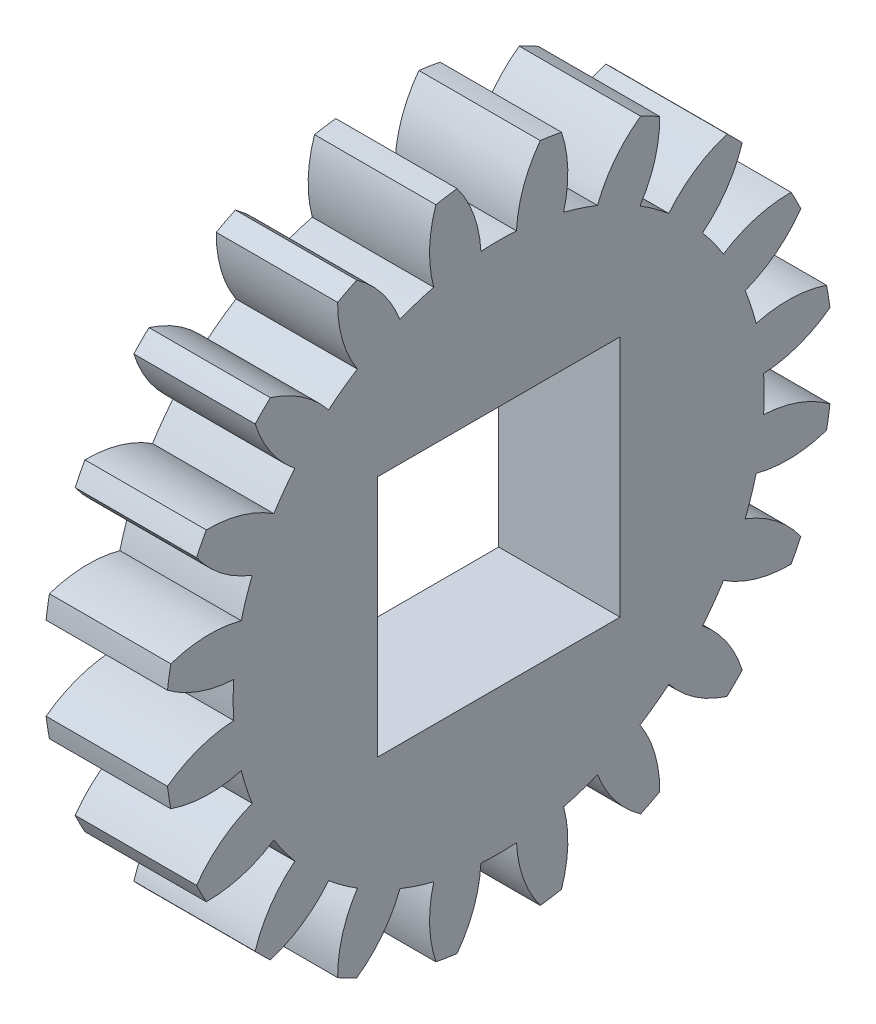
SolidWorks part; units mm, degrees
ref_plane "Plane1" through (0, 0, 0) normal (0, 0, 1) x (1, 0, 0)
ref_plane "Plane2" through (0, 0, 0) normal (0, 1, 0) x (1, 0, 0)
ref_plane "Plane3" through (0, 0, 0) normal (1, 0, 0) x (0, 0, -1)
sketch "HoldingSke" plane through (0, 0, 0) normal (0, 1, 0) x (1, 0, 0)
  line L0 (0, 0) -> (381.8911, -138.997)
  line L1 (-15, 0) -> (100, 0) construction
  line L2 (0, 0) -> (-2.1039, 2.3779)
  line L3 (0, 0) -> (-11.863, 4.5341)
  line L4 (0, 0) -> (8.1152, 2.9537)
  line L5 (0, 0) -> (-47.5972, -17.7524)
  line L6 (0, 0) -> (-5.2639, -3.5516)
  line L7 (-2.1039, 2.3779) -> (8.8308, 51.9871)
  line L8 (-76.2, 54.61) -> (-69.596, 54.61)
  line L9 (-67.7845, 28.3722) -> (-49.3413, 33.142)
  line L10 (-76.2, 71.12) -> (104.1128, 71.12)
  line L11 (0, 0) -> (-6.35, 0)
  line L12 (-76.2, 101.6) -> (-76.1428, 101.6)
  line L13 (24.9733, 27.94) -> (52.9518, 28.4284)
  line L14 (24.9733, 27.94) -> (24.9746, 27.94)
  line L15 (24.9733, 27.94) -> (100.4006, 29.5858)
  circle A0 centre (0, 0) radius 3.175
  circle A1 centre (0, 0) radius 13.8894
  circle A2 centre (0, 0) radius 38.1
  circle A3 centre (0, 0) radius 3.175
  dimension "MHD" = 27.7787
  dimension "Hub_dia" = 76.2
  dimension "Bore" = 6.35
  dimension "MBD" = 6.35
  dimension "Num_teeth" = 20
  dimension "Pitch_radius" = 180.3128
  dimension "Pitch" = 406.4
  dimension "Width" = 6.35
  dimension "Overall_len" = 50.8
  dimension "Show_teeth" = 20
  dimension "Thickness" = 6.35
  dimension "OAL" = 50.8001
  dimension "T_dim" = 6.604
  dimension "Ap" = 14.5
  dimension "H" = 19.05
  dimension "Backlash" = 0.0571
  dimension "Addendum_fac" = 1
  dimension "Dedendum_fac" = 1.25
  dimension "Clearance_fac" = 0.25
  dimension "Dedendum_add" = 0.0013
sketch "BasProSke" plane through (0, 0, 0) normal (0, 1, 0) x (1, 0, 0)
  line L0 (-10, 0) -> (60, 0) construction
  line L1 (0, 0) -> (0, 17.4625)
  line L2 (0, 0) -> (6.35, 0)
  line L3 (6.35, 0) -> (6.35, 17.4625)
  line L4 (6.35, 17.4625) -> (0, 17.4625)
  dimension "Diameter" = 34.925
  dimension "Thickness" = 6.35
revolve "Base-Revolve" add sketch "BasProSke" angle 360 about L0
sketch "TooCutSke" plane through (0, 0, 0) normal (1, 0, 0) x (0, 0, -1)
  line L1 (0, 0) -> (0, 107) construction
  line L2 (0, 0) -> (-1.3455, 15.8179) construction
  line L3 (0, 0) -> (-4.9538, 31.2774) construction
  line L4 (-1.3455, 15.8179) -> (-2.4769, 15.6387) construction
  arc A0 (0.9308, 13.8581) -> (-0.9308, 13.8581) centre (0, 0) ccw
  arc A1 (2.1929, 17.3499) -> (-2.1929, 17.3499) centre (0, 0) ccw
  circle A2 centre (0, 0) radius 15.875 construction
  circle A3 centre (0, 0) radius 15.3693 construction
  arc A4 (-0.9308, 13.8581) -> (-2.1929, 17.3499) centre (-7.2728, 13.5397) ccw
  arc A5 (2.1929, 17.3499) -> (0.9308, 13.8581) centre (7.2728, 13.5397) ccw
  dimension "Root_dia" = 27.7787
  dimension "Overcut_dia" = 34.9758
  dimension "Pitch_dia" = 31.75
  dimension "Base_dia" = 30.7387
  dimension "Flank_rad" = 6.35
  dimension "Half_ang" = 9
  dimension "Half_CT" = 1.1455
extrude "ToothCut" cut sketch "TooCutSke" along normal through all
fillet "Breaks" [suppressed] radius 0.0318
fillet "RootFillets" [suppressed] radius 0.3981
pattern_circular "TeethCuts" count 20 every 18 about axis through (-10, 0, 0) along (1, 0, 0) of "ToothCut", "RootFillets", "Breaks"
sketch "HubNeaOneSke" plane through (0, 0, 0) normal (-1, 0, 0) x (0, 0, 1)
  circle A0 centre (0, 0) radius 13.8894
  dimension "Diameter" = 27.7787
extrude "HubNearOne" [suppressed] add sketch "HubNeaOneSke" along normal blind 44.4501
sketch "HubNeaBotSke" plane through (0, 0, 0) normal (-1, 0, 0) x (0, 0, 1)
  circle A0 centre (0, 0) radius 13.8894
  dimension "Diameter" = 27.7787
extrude "HubNearBoth" [suppressed] add sketch "HubNeaBotSke" along normal blind 22.225
ref_plane "FarPln" through (6.35, 0, 0) normal (1, 0, 0) x (0, 0, -1)
sketch "HubFarSke" plane through (6.35, 0, 0) normal (1, 0, 0) x (0, 0, -1)
  circle A0 centre (0, 0) radius 13.8894
  dimension "Diameter" = 27.7787
extrude "HubFar" [suppressed] add sketch "HubFarSke" along normal blind 22.225
sketch "BorSke" plane through (0, 0, 0) normal (1, 0, 0) x (0, 0, -1)
  circle A0 centre (0, 0) radius 3.175
  dimension "Diameter" = 6.35
extrude "Bore" cut sketch "BorSke" along normal mid plane 101.6001
sketch "KeySke" plane through (0, 0, 0) normal (1, 0, 0) x (0, 0, -1)
  line L0 (-0.127, 0) -> (-0.127, 3.429)
  line L1 (-0.127, 3.429) -> (0.127, 3.429)
  line L2 (0.127, 3.429) -> (0.127, 0)
  line L3 (0, 0) -> (0, 34) construction
  line L4 (-0.127, 0) -> (0.127, 0)
  dimension "Offset" = 3.429
  dimension "Width" = 0.254
extrude "Keyway" [suppressed] cut sketch "KeySke" along normal mid plane 101.6001
pattern_circular "Keyway2" [suppressed] count 2 every 90 about axis through (-10, 0, 0) along (1, 0, 0)
sketch "Sketch1" plane through (0, 0, 0) normal (1, 0, 0) x (0, 0, -1)
  line L1 (6.35, -6.35) -> (-6.35, -6.35)
  line L2 (6.35, -6.35) -> (6.35, 6.35)
  line L3 (6.35, 6.35) -> (-6.35, 6.35)
  line L4 (-6.35, -6.35) -> (-6.35, 6.35)
  line L5 (6.35, -6.35) -> (-6.35, 6.35) construction
  line L6 (6.35, 6.35) -> (-6.35, -6.35) construction
  point P0 (0, 0)
  dimension "D1" = 12.7
extrude "Cut-Extrude1" cut sketch "Sketch1" along normal blind 9.144
scale "Scale1" scale about centroid uniform scaling yes scale factor 0.5
equation "' \"Pitch@HoldingSke\" = 4"
equation "' \"Num_teeth@HoldingSke\" = 12"
equation "' \"Ap@HoldingSke\" =  20"
equation "' \"Width@HoldingSke\" = 0.5"
equation "' \"Hub_dia@HoldingSke\"= 1"
equation "' \"Overall_len@HoldingSke\" = 1.0"
equation "' \"Bore@HoldingSke\" = 0.75"
equation "' \"T_dim@HoldingSke\" = 0.85"
equation "' \"Width@KeySke\" = 0.25"
equation "' \"Show_teeth@HoldingSke\" = 13"
equation "' \"Backlash@HoldingSke\" = 0.009"
equation "' \"Addendum_fac@HoldingSke\" = 1.0"
equation "' \"Dedendum_fac@HoldingSke\" = 1.25"
equation "' \"Dedendum_add@HoldingSke\" = 0.00005"
equation "' \"Clearance_fac@HoldingSke\" = 0.25"
equation "' \"Pitch@HoldingSke\" = 0.5"
equation "' \"Num_teeth@HoldingSke\" = 23"
equation "' \"Show_teeth@HoldingSke\" = 23"
equation "' \"Backlash@HoldingSke\" = 0.0375"
equation "\"Overcut_dia@TooCutSke\" = (\"Num_teeth@HoldingSke\" + 2 * \"Addendum_fac@HoldingSke\") / \"Pitch@HoldingSke\" + 0.002"
equation "\"Pitch_dia@TooCutSke\" = \"Num_teeth@HoldingSke\" / \"Pitch@HoldingSke\""
equation "\"Base_dia@TooCutSke\" = \"Num_teeth@HoldingSke\" / \"Pitch@HoldingSke\" * cos((\"Ap@HoldingSke\"  * 3.14159265 / 180))"
equation "\"Root_dia@TooCutSke\" = (\"Num_teeth@HoldingSke\" + 2) / \"Pitch@HoldingSke\" - 2 * (\"Addendum_fac@HoldingSke\" + \"Dedendum_fac@HoldingSke\") / \"Pitch@HoldingSke\" - \"Dedendum_add@HoldingSke\" * 2"
equation "\"Half_ang@TooCutSke\" = 180 / \"Num_teeth@HoldingSke\""
equation "\"Half_CT@TooCutSke\" = \"Num_teeth@HoldingSke\" / \"Pitch@HoldingSke\" * sin((3.14159265 / 2 / \"Num_teeth@HoldingSke\")) / 2 - 7 * \"Backlash@HoldingSke\" / 4"
equation "\"Flank_rad@TooCutSke\" = \"Num_teeth@HoldingSke\" / \"Pitch@HoldingSke\" / 5"
equation "\"Radius@RootFillets\" = \"Clearance_fac@HoldingSke\" / \"Pitch@HoldingSke\" + \"Dedendum_add@HoldingSke\""
equation "\"Break_rad@Breaks\" = 0.02 / \"Pitch@HoldingSke\""
equation "\"Thickness@HoldingSke\" = \"Width@HoldingSke\""
equation "\"OAL@HoldingSke\" = \"Thickness@HoldingSke\""
equation "\"MHD@HoldingSke\" = (\"Num_teeth@HoldingSke\" + 2) / \"Pitch@HoldingSke\" - 2 * (\"Addendum_fac@HoldingSke\" + \"Dedendum_fac@HoldingSke\")  / \"Pitch@HoldingSke\" - \"Dedendum_add@HoldingSke\" * 2"
equation "\"MBD@HoldingSke\" = (\"Num_teeth@HoldingSke\" + 2) / \"Pitch@HoldingSke\" - 2 * (\"Addendum_fac@HoldingSke\" + \"Dedendum_fac@HoldingSke\")  / \"Pitch@HoldingSke\" - \"Dedendum_add@HoldingSke\" * 2 - 0.002"
equation "\"MHD@HoldingSke\" = ((sgn( \"MHD@HoldingSke\" - \"Hub_dia@HoldingSke\" )-1)*( \"MHD@HoldingSke\" - \"Hub_dia@HoldingSke\" ))/-2+ \"Hub_dia@HoldingSke\""
equation "\"MBD@HoldingSke\" = ((sgn( \"MBD@HoldingSke\" - \"Bore@HoldingSke\" )-1)*( \"MBD@HoldingSke\" - \"Bore@HoldingSke\" ))/-2+ \"Bore@HoldingSke\""
equation "\"OAL@HoldingSke\" = ((sgn( \"OAL@HoldingSke\" - \"Overall_len@HoldingSke\" )+1)*( \"OAL@HoldingSke\" - \"Overall_len@HoldingSke\" ))/2 + \"Overall_len@HoldingSke\" + 0.000002"
equation "\"Num_teeth@TeethCuts\" = int( \"Show_teeth@HoldingSke\" ) + 1"
equation "\"Num_teeth@TeethCuts\" = ((sgn( \"Num_teeth@TeethCuts\" - \"Num_teeth@HoldingSke\" )-1)*( \"Num_teeth@TeethCuts\" - \"Num_teeth@HoldingSke\" ))/-2+ \"Num_teeth@HoldingSke\""
equation "\"Num_teeth@TeethCuts\" = ((sgn( \"Num_teeth@TeethCuts\" - 2.0)+1)*( \"Num_teeth@TeethCuts\" - 2.0))/2 +2.0"
equation "\"Angle@TeethCuts\" = 360.0 / \"Num_teeth@HoldingSke\""
equation "\"Diameter@BasProSke\" = (\"Num_teeth@HoldingSke\" + 2 * \"Addendum_fac@HoldingSke\") / \"Pitch@HoldingSke\""
equation "\"Thickness@BasProSke\"  = \"Thickness@HoldingSke\""
equation "' \"Fillet_rad@BasProSke\" =  \"Thickness@HoldingSke\" * 0.05"
equation "\"MHD@HoldingSke\" = ((sgn( \"MHD@HoldingSke\" - \"Root_dia@TooCutSke\" )-1)*( \"MHD@HoldingSke\" - \"Root_dia@TooCutSke\" ))/-2+ \"Root_dia@TooCutSke\""
equation "\"Diameter@HubNeaOneSke\" = \"MHD@HoldingSke\""
equation "\"Length@HubNearOne\" = \"OAL@HoldingSke\" - \"Thickness@BasProSke\""
equation "\"Diameter@HubNeaBotSke\" = \"MHD@HoldingSke\""
equation "\"Length@HubNearBoth\" = ( \"OAL@HoldingSke\" - \"Thickness@BasProSke\" ) / 2.0"
equation "\"Thickness@FarPln\" = \"Thickness@BasProSke\""
equation "\"Diameter@HubFarSke\" = \"MHD@HoldingSke\""
equation "\"Length@HubFar\" = ( \"OAL@HoldingSke\" - \"Thickness@BasProSke\" ) / 2.0"
equation "\"Diameter@BorSke\" = \"MBD@HoldingSke\""
equation "\"D1@Bore\" = \"OAL@HoldingSke\" * 2.0"
equation "\"D1@Keyway\" = \"OAL@HoldingSke\" * 2.0"
equation "\"Offset@KeySke\" = \"T_dim@HoldingSke\" - \"MBD@HoldingSke\" / 2.0"
